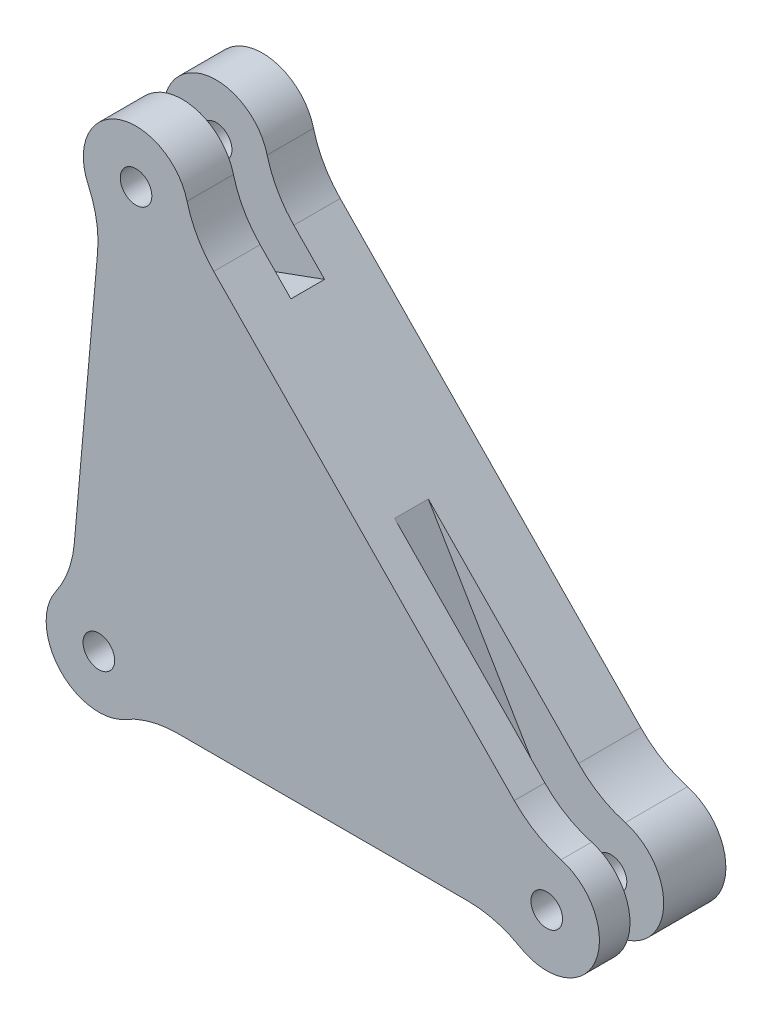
SolidWorks part; units mm, degrees
other "<piece triengle haut imp>-<Chanfrein1>"
ref_plane "Plan de face" through (0, 0, 0) normal (0, 0, 1) x (1, 0, 0)
ref_plane "Plan de dessus" through (0, 0, 0) normal (0, 1, 0) x (1, 0, 0)
ref_plane "Plan de droite" through (0, 0, 0) normal (1, 0, 0) x (0, 0, -1)
mirrored part "piece triengle haut imp_Symétrique"
sketch3d "Esquisse3D4" plane through (0, 0, 0) normal (0, 0, 1) x (1, 0, 0)
  dimension "D1" = 2.7
sketch "Esquisse1" plane through (0, 0, -12) normal (0, 0, -1) x (-1, 0, 0)
  line L0 (44.8298, 7.7183) -> (55.0167, 7.7183)
  line L1 (55.0167, 7.7183) -> (55.0167, -11.2817)
  line L2 (55.0167, -11.2817) -> (35.0167, -11.2817)
  line L3 (35.0167, -11.2817) -> (35.0167, -3)
  line L4 (42.4641, 0.0329) -> (17.8403, 22.577) construction
  line L5 (3.0794, 7.451) -> (31.598, 36.6751) construction
  arc A0 (44.8298, 7.7183) -> (35.0167, -3) centre (35.5419, 6.3705) cw
  point P3 (36.9764, 5.0571)
  point P10 (17.8403, 22.577)
  dimension "D1" = 24
  dimension "D2" = 19
  dimension "D3" = 20
